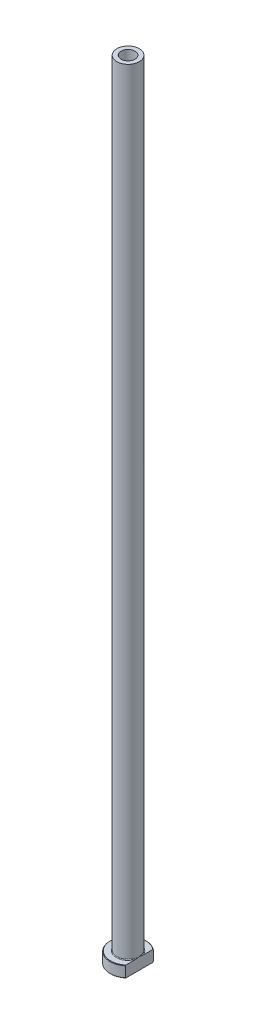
SolidWorks part; units mm, degrees
ref_plane "Front Plane" through (0, 0, 0) normal (0, 0, 1) x (1, 0, 0)
ref_plane "Top Plane" through (0, 0, 0) normal (0, 1, 0) x (1, 0, 0)
ref_plane "Right Plane" through (0, 0, 0) normal (1, 0, 0) x (0, 0, -1)
sketch "Sketch1" plane through (0, 0, 0) normal (0, 0, 1) x (1, 0, 0)
  line L0 (-3.1, 350) -> (-5, 350)
  line L1 (-5, 350) -> (-5, 5)
  line L2 (-5, 5) -> (-8, 5)
  line L3 (-8, 5) -> (-8, 0)
  line L4 (7.15, 0) -> (-7.15, 0) construction
  line L5 (-8, 0) -> (-3.35, 0)
  line L6 (-3.1, 305) -> (-3.1, 350)
  line L7 (0, 92.1877) -> (0, -15.5353) construction
  line L8 (0, -8.8) -> (0, 8.8) construction
  line L9 (-3.1, 305) -> (-3.35, 293)
  line L10 (-3.35, 293) -> (-3.35, 0)
  dimension "D1" = 0.25
  dimension "ID" = 6.2
  dimension "OD" = 10
  dimension "L" = 350
  dimension "H" = 16
  dimension "T" = 5
  dimension "N" = 45
  dimension "D2" = 12
  dimension "L-N" = 305
revolve "Revolve1" add sketch "Sketch1" angle 360 about L7
fillet "Fillet1" radius 0.3 1 edges at (0, 5, 5)
chamfer "Chamfer1" distance 0.2 angle 45 2 edges at (0, 5, 8) (0, 0, 8)
sketch "Sketch2" plane through (0, 0, 0) normal (0, -1, 0) x (1, 0, 0)
  line L0 (5, 6.245) -> (5, -6.245)
  circle A0 centre (0, 0) radius 8 construction
  arc A1 (5, 6.245) -> (5, -6.245) centre (0, 0) cw
  circle A2 centre (0, 0) radius 5 construction
extrude "Cut-Extrude1" cut sketch "Sketch2" against normal through all
chamfer "Chamfer2" distance 0.5 angle 45 1 edges at (0, 0, 3.35)
